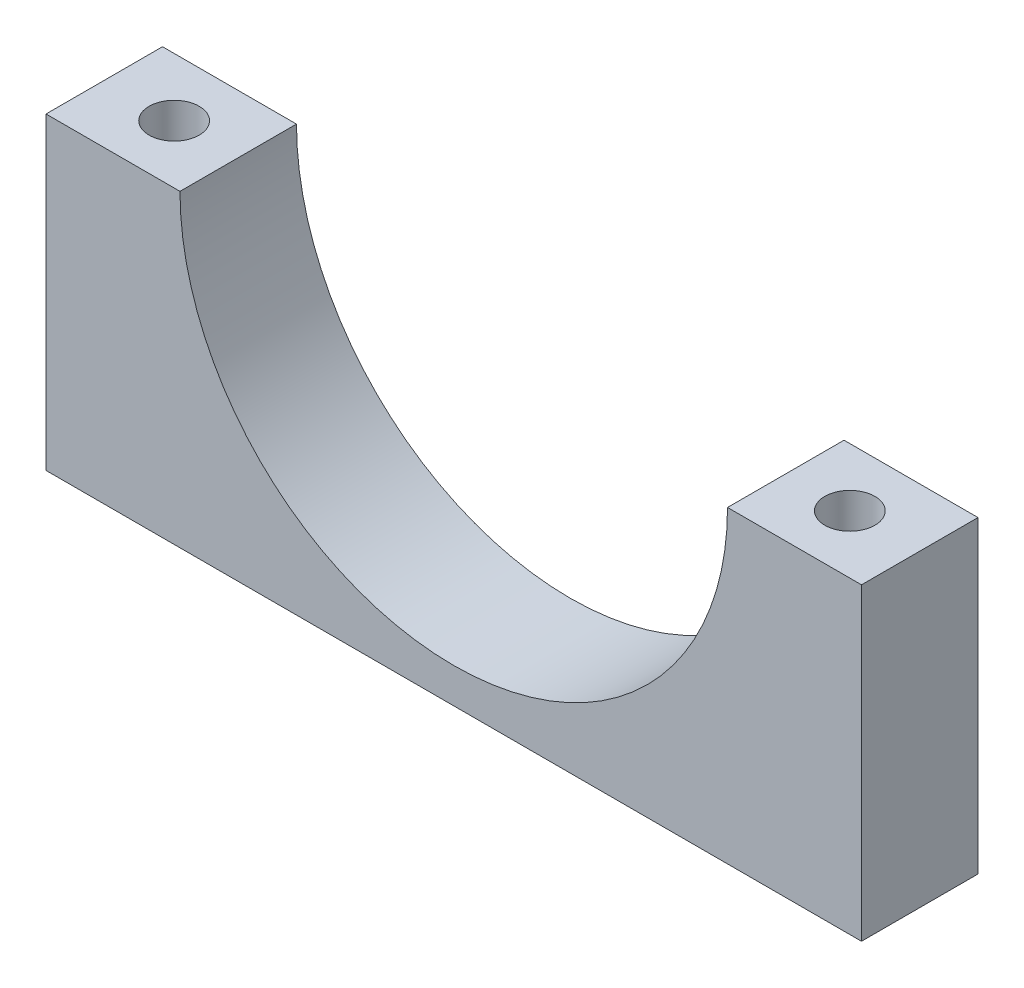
SolidWorks part; units mm, degrees
ref_plane "Plan de face" through (0, 0, 0) normal (0, 0, 1) x (1, 0, 0)
ref_plane "Plan de dessus" through (0, 0, 0) normal (0, 1, 0) x (1, 0, 0)
ref_plane "Plan de droite" through (0, 0, 0) normal (1, 0, 0) x (0, 0, -1)
sketch "Esquisse1" plane through (0, 0, 0) normal (0, 0, 1) x (1, 0, 0)
  line L0 (-50.5, -25) -> (-39, -25)
  line L1 (-39, -25) -> (-39, -51.5)
  line L2 (-39, -51.5) -> (-109, -51.5)
  line L3 (-109, -51.5) -> (-109, -25)
  line L4 (-109, -25) -> (-97.5, -25)
  arc A0 (-50.5, -25) -> (-97.5, -25) centre (-74, -25) cw
  arc A1 (-50.5, -25) -> (-97.5, -25) centre (-74, -25) ccw construction
extrude "Extrusion1" add sketch "Esquisse1" against normal up to surface (10 mm away)
hole_wizard "Chambrage pour vis à tête hexagonale M52" positions "Esquisse5" profile "Esquisse4" counterbore size "M4" standard "ISO"
sketch "Esquisse5" plane through (0, -51.5, 0) normal (0, -1, 0) x (1, 0, 0)
  line L0 (-109, 0) -> (-39, 0) construction
  line L1 (-109, -10) -> (-109, 0) construction
  point P0 (-103, -5)
  dimension "D1" = 5
  dimension "D2" = 6
sketch "Esquisse4" plane through (-103, -51.5, -5) normal (1, 0, 0) x (0, 0, -1)
  line L0 (0, 0) -> (0, 26.5)
  line L1 (0, 26.5) -> (2.15, 26.5)
  line L3 (2.15, 26.5) -> (2.15, 4)
  line L4 (2.15, 4) -> (4, 4)
  line L5 (4, 4) -> (4, 0)
  line L7 (4, 0) -> (0, 0)
  line L11 (0, -6.35) -> (0, 107.95) construction
  dimension "Diamètre du perçage jusqu'au prochain" = 4.3
  dimension "Profondeur du perçage jusqu'au prochain" = 26.5
  dimension "Diamètre du chambrage" = 8
  dimension "Profondeur du chambrage" = 4
pattern_linear "Répétition linéaire1" count 2 spacing 58 along (1, 0, 0) of "Chambrage pour vis à tête hexagonale M52"
